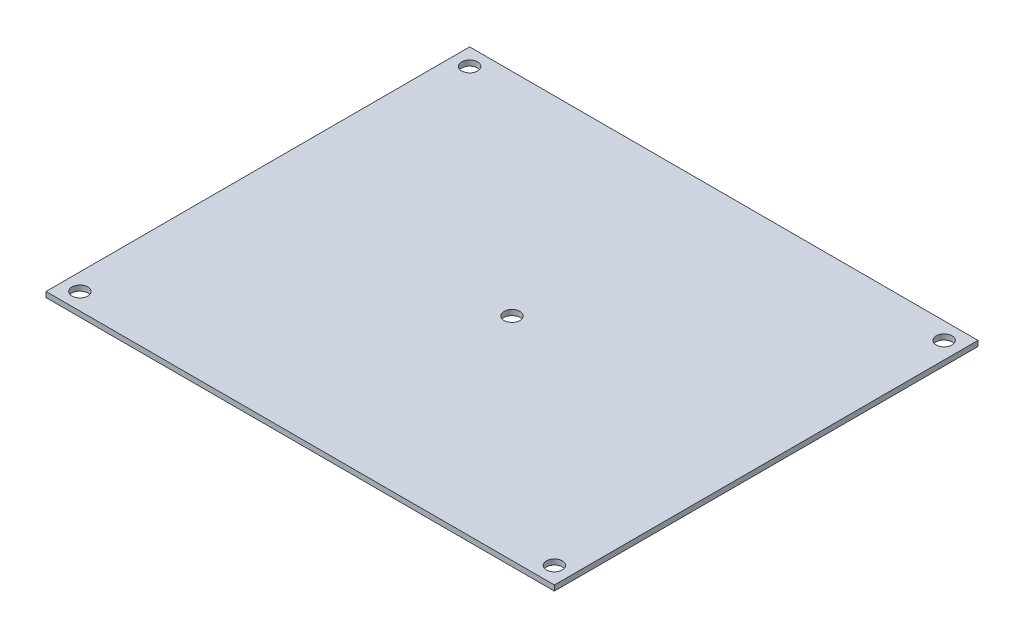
SolidWorks part; units mm, degrees
ref_plane "Front" through (0, 0, 0) normal (0, 0, 1) x (1, 0, 0)
ref_plane "Top" through (0, 0, 0) normal (0, 1, 0) x (1, 0, 0)
ref_plane "Right" through (0, 0, 0) normal (1, 0, 0) x (0, 0, -1)
sketch "Sketch1" plane through (0, 0, 0) normal (0, 1, 0) x (1, 0, 0)
  line L0 (-76.2, 0) -> (14.9618, 0) construction
  line L1 (-76.2, 63.5) -> (76.2, 63.5)
  line L2 (-76.2, 63.5) -> (-76.2, -63.5)
  line L3 (-76.2, -63.5) -> (76.2, -63.5)
  line L4 (76.2, 63.5) -> (76.2, -63.5)
  line L5 (0, 63.5) -> (0, -18.9949) construction
  dimension "D1" = 152.4
  dimension "D2" = 127
extrude "Extrude1" add sketch "Sketch1" along normal blind 1.6002
sketch "Sketch2" plane through (0, 1.6002, 0) normal (0, 1, 0) x (-1, 0, 0)
  line L0 (-76.2, 63.5) -> (-76.2, -63.5) construction
  line L1 (-76.2, -63.5) -> (76.2, -63.5) construction
  line L2 (-71.12, -58.42) -> (-56.0582, -58.42) construction
  line L3 (71.12, -58.42) -> (60.5144, -58.42) construction
  line L4 (71.12, -58.42) -> (71.12, -81.8742) construction
  line L5 (71.12, 58.42) -> (71.12, 75.1231) construction
  line L6 (71.12, 58.42) -> (57.3208, 58.42) construction
  line L7 (-71.12, 58.42) -> (-48.6462, 58.42) construction
  line L8 (-71.12, 58.42) -> (-71.12, 78.0864) construction
  line L9 (76.2, 63.5) -> (-76.2, 63.5) construction
  line L10 (76.2, -63.5) -> (76.2, 63.5) construction
  line L11 (-71.12, -58.42) -> (-71.12, -39.0135) construction
  circle A0 centre (-71.12, -58.42) radius 2.3749
  circle A1 centre (71.12, -58.42) radius 2.3749
  circle A2 centre (71.12, 58.42) radius 2.3749
  circle A3 centre (-71.12, 58.42) radius 2.3749
  circle A4 centre (0, 0) radius 2.3749
  dimension "D1" = 4.7498
  dimension "D2" = 5.08
  dimension "D3" = 5.08
  dimension "D4" = 4.7498
  dimension "D5" = 4.7498
  dimension "D6" = 4.7498
  dimension "D7" = 5.08
  dimension "D8" = 5.08
  dimension "D9" = 4.7498
extrude "Cut-Extrude1" cut sketch "Sketch2" against normal through all
